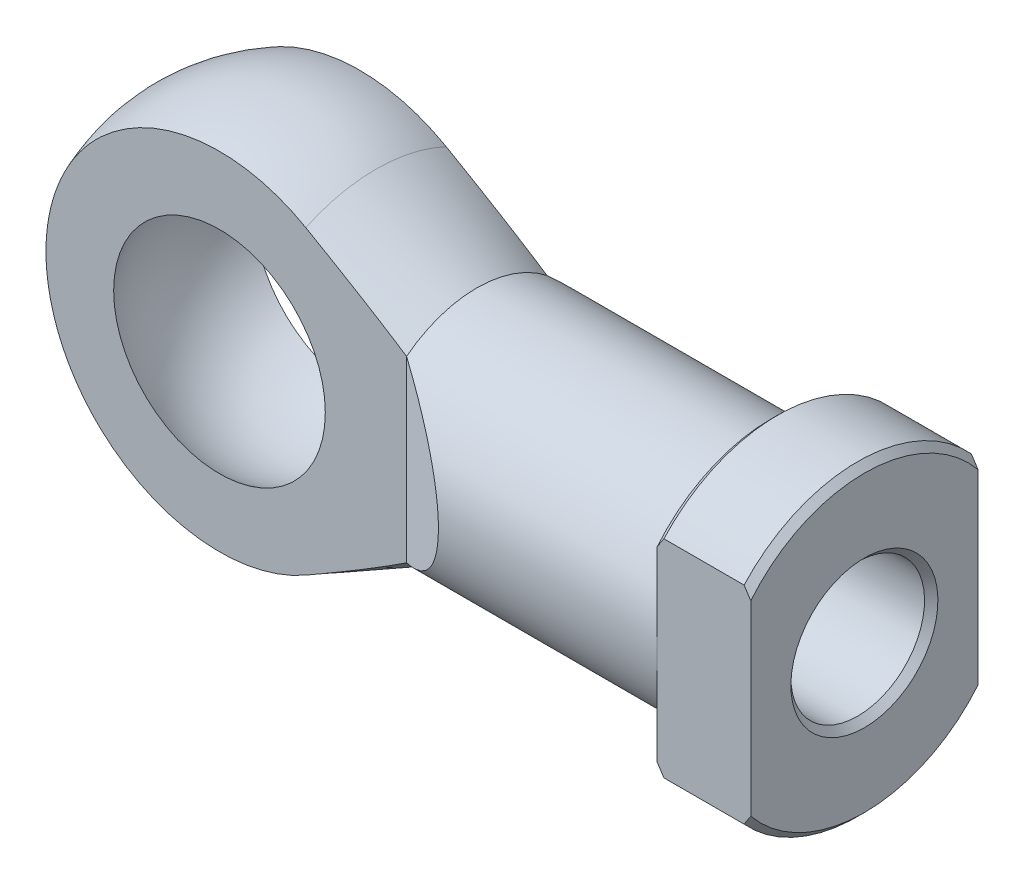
SolidWorks part; units mm, degrees
ref_plane "Plan1" through (0, 0, 0) normal (0, 0, 1) x (1, 0, 0)
ref_plane "Plan2" through (0, 0, 0) normal (0, 1, 0) x (1, 0, 0)
ref_plane "Plan3" through (0, 0, 0) normal (1, 0, 0) x (0, 0, -1)
sketch "Esquisse2" plane through (0, 0, 0) normal (0, 0, 1) x (1, 0, 0)
  line L0 (0, 0) -> (43, 0) construction
  line L1 (-14, 0) -> (43, 0) construction
  line L2 (43, -11.5) -> (43, 11.5) construction
  line L3 (14, 8.5) -> (6.4585, 12.4212) construction
  line L4 (36, 8.5) -> (14, 8.5) construction
  line L5 (36, 11.5) -> (36, 8.5) construction
  line L6 (43, 11.5) -> (36, 11.5) construction
  line L7 (43, 5) -> (43, 11.5)
  line L8 (14, 8.5) -> (6.4585, 12.4212)
  line L9 (36, 8.5) -> (14, 8.5)
  line L10 (36, 11.5) -> (36, 8.5)
  line L11 (43, 11.5) -> (36, 11.5)
  line L12 (43, 5) -> (23, 5) construction
  line L13 (23, 5) -> (23, -5) construction
  line L14 (43, 5) -> (23, 5)
  line L15 (23, 5) -> (23, 0)
  line L16 (23, 0) -> (-14, 0)
  arc A0 (6.4585, 12.4212) -> (6.4585, -12.4212) centre (0, 0) ccw construction
  arc A1 (6.4585, 12.4212) -> (-14, 0) centre (0, 0) ccw
revolve "Base-Révolution" add sketch "Esquisse2" angle 360 about L1
sketch "Esquisse4" plane through (0, 0, 0) normal (0, 1, 0) x (1, 0, 0)
  line L0 (-12.9783, -5.25) -> (-12.9783, -14) construction
  line L1 (-12.9783, -14) -> (29.1554, -14) construction
  line L2 (14, -5.25) -> (29.1554, -14) construction
  line L3 (-12.9783, -5.25) -> (14, -5.25) construction
  line L4 (-12.9783, 5.25) -> (-12.9783, 14) construction
  line L5 (-12.9783, 5.25) -> (14, 5.25) construction
  line L6 (14, 5.25) -> (29.1554, 14) construction
  line L7 (-12.9783, 14) -> (29.1554, 14) construction
  line L8 (-12.9783, -5.25) -> (-12.9783, -14)
  line L9 (-12.9783, -14) -> (29.1554, -14)
  line L10 (14, -5.25) -> (29.1554, -14)
  line L11 (-12.9783, -5.25) -> (14, -5.25)
  line L12 (-12.9783, 5.25) -> (-12.9783, 14)
  line L13 (-12.9783, 5.25) -> (14, 5.25)
  line L14 (14, 5.25) -> (29.1554, 14)
  line L15 (-12.9783, 14) -> (29.1554, 14)
extrude "Enlèv. mat.-Extru.2" cut sketch "Esquisse4" against normal through all and the other way through all
sketch "Esquisse5" plane through (0, 0, 0) normal (0, 0, 1) x (1, 0, 0)
  line L0 (0, 0) -> (43, 0) construction
  line L1 (-9.5, 0) -> (9.5, 0) construction
  line L2 (9.5, 0) -> (-9.5, 0)
  arc A1 (9.5, 0) -> (-9.5, 0) centre (0, 0) ccw
  dimension "D1" = 9.5
revolve "Enlèvement de matière-Révolution1" cut sketch "Esquisse5" angle 360 about L1
sketch "Esquisse6" plane through (43, 0, 0) normal (1, 0, 0) x (0, 0, -1)
  line L0 (-8.5, 7.746) -> (-8.5, -7.746)
  line L1 (0, 0) -> (0, 7.746) construction
  line L2 (8.5, 7.746) -> (8.5, -7.746)
  circle A0 centre (0, 0) radius 8.5 construction
  circle A1 centre (0, 0) radius 8.5 construction
  circle A2 centre (0, 0) radius 11.5 construction
  arc A3 (-8.5, 7.746) -> (-8.5, -7.746) centre (0, 0) ccw
  arc A4 (8.5, 7.746) -> (8.5, -7.746) centre (0, 0) cw
extrude "Enlèv. mat.-Extru.3" cut sketch "Esquisse6" against normal through all
chamfer "Chanfrein1" distance 0.5 angle 45 5 edges at (43, 11.5, 0) (36, 11.5, 0) (43, -5, 0) (43, -11.5, 0) (36, -11.5, 0)
